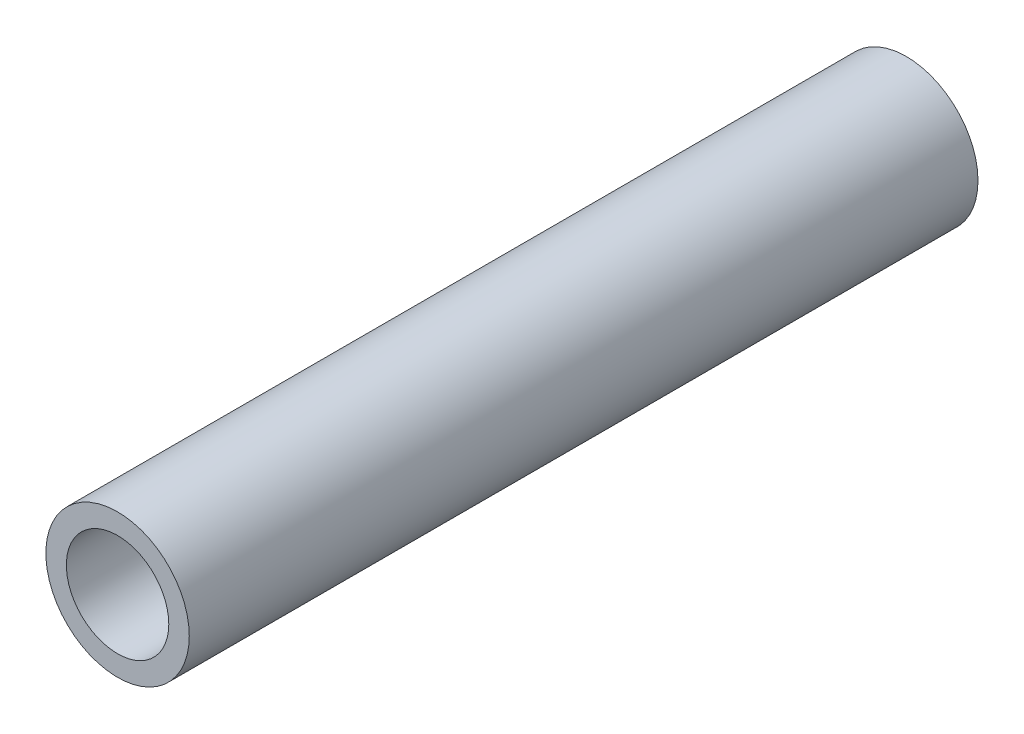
SolidWorks part; units mm, degrees
ref_plane "Plan de face" through (0, 0, 0) normal (0, 0, 1) x (1, 0, 0)
ref_plane "Plan de dessus" through (0, 0, 0) normal (0, 1, 0) x (1, 0, 0)
ref_plane "Plan de droite" through (0, 0, 0) normal (1, 0, 0) x (0, 0, -1)
sketch "Esquisse1" plane through (0, 0, 0) normal (0, 0, 1) x (1, 0, 0)
  circle A0 centre (0, 0) radius 14
  circle A1 centre (0, 0) radius 10
  dimension "D2" = 20
  dimension "D1" = 28
extrude "Extrusion1" add sketch "Esquisse1" along normal blind 154
